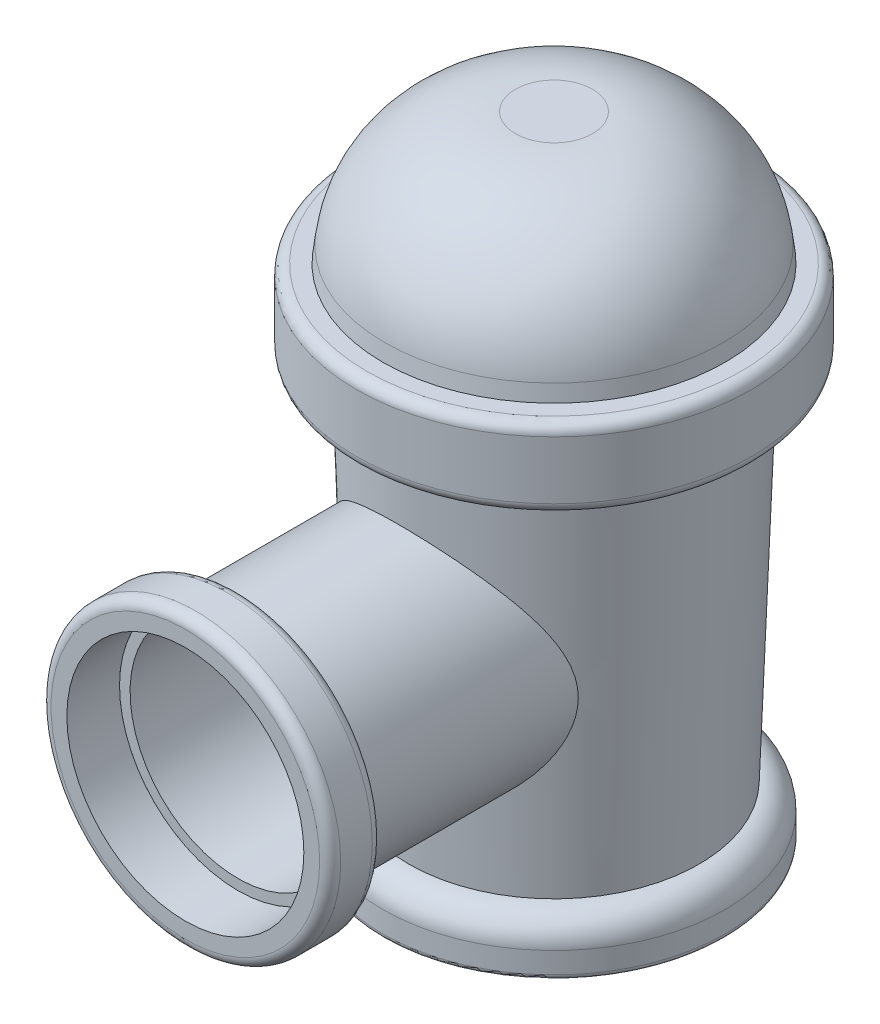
SolidWorks part; units mm, degrees
ref_plane "Alzado" through (0, 0, 0) normal (0, 0, 1) x (1, 0, 0)
ref_plane "Planta" through (0, 0, 0) normal (0, 1, 0) x (1, 0, 0)
ref_plane "Vista lateral" through (0, 0, 0) normal (1, 0, 0) x (0, 0, -1)
sketch "Croquis1" plane through (0, 0, 0) normal (0, 1, 0) x (1, 0, 0)
  circle A0 centre (0, 0) radius 30
  dimension "D1" = 60
extrude "Saliente-Extruir1" add sketch "Croquis1" against normal blind 70 draft 2
sketch "Croquis2" plane through (0, 0, 0) normal (0, 1, 0) x (1, 0, 0)
  circle A0 centre (0, 0) radius 37.5
  dimension "D1" = 75
extrude "Saliente-Extruir2" add sketch "Croquis2" along normal blind 15
sketch "Croquis3" plane through (0, -70, 0) normal (0, -1, 0) x (1, 0, 0)
  circle A3 centre (0, 0) radius 32.5
  dimension "D1" = 65
sketch "Croquis4" plane through (0, 15, 0) normal (0, 1, 0) x (1, 0, 0)
  circle A0 centre (0, 0) radius 32.5
  dimension "D1" = 65
extrude "Saliente-Extruir3" add sketch "Croquis4" along normal blind 25 draft 7
fillet "Redondeo1" radius 25 1 edges at (0, 40, 29.4304)
sketch "Croquis5" plane through (0, 0, 0) normal (0, 0, 1) x (1, 0, 0)
  circle A0 centre (0, -35.6437) radius 22.5
  dimension "D1" = 45
extrude "Saliente-Extruir4" add sketch "Croquis5" along normal blind 60
sketch "Croquis6" plane through (0, 0, 60) normal (0, 0, 1) x (1, 0, 0)
  circle A0 centre (0, -35.6437) radius 27.5
  dimension "D1" = 55
extrude "Saliente-Extruir5" add sketch "Croquis6" along normal blind 10
fillet "Redondeo2" radius 2 3 edges at (0, 15, 37.5) (0, 0, 37.5) (27.5, -35.6437, 60)
extrude "Saliente-Extruir6" add sketch "Croquis3" along normal blind 10
fillet "Redondeo3" radius 5 1 edges at (0, -70, -32.5)
fillet "Redondeo4" radius 1 1 edges at (0, -80, -32.5)
sketch "Croquis7" plane through (0, -80, 0) normal (0, -1, 0) x (1, 0, 0)
  circle A0 centre (0, 0) radius 22.5
  dimension "D1" = 45
extrude "Cortar-Extruir1" cut sketch "Croquis7" against normal blind 10
sketch "Croquis8" plane through (0, 0, 70) normal (0, 0, 1) x (1, 0, 0)
  circle A0 centre (0, -35.6437) radius 22.5
  dimension "D1" = 45
extrude "Cortar-Extruir2" cut sketch "Croquis8" against normal blind 10
fillet "Redondeo5" radius 2 1 edges at (27.5, -35.6437, 70)
shell "Vaciado2" thickness 2
